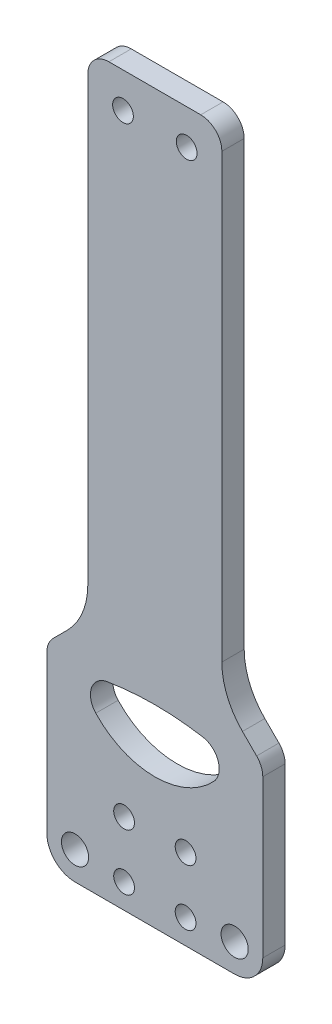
SolidWorks part; units mm, degrees
ref_plane "Front" through (0, 0, 0) normal (0, 0, 1) x (1, 0, 0)
ref_plane "Top" through (0, 0, 0) normal (0, 1, 0) x (1, 0, 0)
ref_plane "Right" through (0, 0, 0) normal (1, 0, 0) x (0, 0, -1)
sketch "Sketch1" plane through (0, 0, 0) normal (0, 0, 1) x (1, 0, 0)
  circle B0 centre (0, 0) radius 41 construction
  circle B1 centre (0, 0) radius 1.5875
  circle B2 centre (0, 0) radius 43.815
  circle B3 centre (0, 0) radius 10
  circle B4 centre (-19.1, -33.0822) radius 2.8
  circle B5 centre (-33.0822, -19.1) radius 1.5875
  circle B6 centre (0, -38.2) radius 1.5875
  circle B7 centre (-38.2, 0) radius 2.8
  circle B8 centre (-33.0822, 19.1) radius 1.5875
  circle B9 centre (-19.1, 33.0822) radius 2.8
  circle B10 centre (0, 38.2) radius 1.5875
  circle B11 centre (19.1, 33.0822) radius 2.8
  circle B12 centre (33.0822, 19.1) radius 1.5875
  circle B13 centre (38.2, 0) radius 2.8
  circle B14 centre (0, -38.2) radius 2.8
  circle B15 centre (33.0822, -19.1) radius 2.8
  circle B16 centre (19.1, -33.0822) radius 1.5875
  circle B17 centre (6.35, 37.6685) radius 1.5875
  circle B18 centre (-6.35, 37.6685) radius 1.5875
  line B19 (0, 0) -> (0, 41) construction
  circle B20 centre (6.35, 37.6685) radius 2.8 construction
  line B21 (0.8133, 36.6558) -> (-4.9156, 40.0732) construction
  circle B22 centre (0, 35.2924) radius 1.5875 construction
  circle B23 centre (0, 35.2924) radius 3.175 construction
  line B24 (0, -38.2) -> (0, 0) construction
  circle B25 centre (-19.1, -33.0822) radius 1.5875
  circle B26 centre (19.1, -33.0822) radius 2.8
  circle B27 centre (33.0822, -19.1) radius 1.5875
  circle B28 centre (38.2, 0) radius 1.5875
  circle B29 centre (33.0822, 19.1) radius 2.8
  circle B30 centre (19.1, 33.0822) radius 1.5875
  circle B31 centre (0, 38.2) radius 2.8
  circle B32 centre (-19.1, 33.0822) radius 1.5875
  circle B33 centre (-33.0822, 19.1) radius 2.8
  circle B34 centre (-38.2, 0) radius 1.5875
  circle B35 centre (-33.0822, -19.1) radius 2.8
  arc B36 (6.8154, 40.4296) -> (-6.8154, 40.4296) centre (0, 0) cw
  arc B37 (-6.8154, 40.4296) -> (-4.9156, 40.0732) centre (-6.35, 37.6685) cw
  circle B38 centre (-6.35, 37.6685) radius 2.8 construction
  arc B39 (-3.7276, 36.6872) -> (-4.9156, 40.0732) centre (-6.35, 37.6685) ccw
  line B40 (3.9049, 39.0328) -> (1.3863, 34.5189) construction
  line B41 (4.3688, 17) -> (4.3688, 25) construction
  circle B42 centre (4.3688, 25) radius 1.9304
  circle B43 centre (4.3688, 17) radius 1.9304
  circle B44 centre (-4.3688, 17) radius 1.9304
  circle B45 centre (-4.3688, 25) radius 1.9304
  line B46 (0, 48.315) -> (0, 135.945) construction
  line B47 (6.35, 48.315) -> (3.175, 48.315)
  line B48 (3.175, 135.945) -> (6.35, 135.945)
  line B49 (3.175, 135.945) -> (3.175, 133.13)
  line B50 (3.175, 48.315) -> (3.175, 51.13)
  line B51 (1.5875, 51.13) -> (3.175, 51.13)
  line B52 (0, 51.13) -> (1.5875, 51.13)
  line B53 (1.5875, 133.13) -> (3.175, 133.13)
  line B54 (0, 133.13) -> (1.5875, 133.13)
  line B55 (-6.35, 135.945) -> (-6.35, 48.315)
  line B56 (6.35, 135.945) -> (6.35, 48.315)
  line B57 (-3.175, 133.13) -> (0, 133.13)
  line B58 (-3.175, 135.945) -> (-6.35, 135.945)
  line B59 (-3.175, 135.945) -> (-3.175, 133.13)
  line B60 (6.35, 109.13) -> (-6.35, 109.13) construction
  line B61 (6.35, 106.8526) -> (-6.35, 106.8526) construction
  line B62 (0, 92.13) -> (6.35, 92.13) construction
  line B63 (0, 43.815) -> (0, 48.315) construction
  line B64 (-3.175, 51.13) -> (0, 51.13)
  line B65 (-3.175, 48.315) -> (-3.175, 51.13)
  line B66 (-6.35, 48.315) -> (-3.175, 48.315)
  line B67 (6.35, 102.13) -> (9.525, 102.13)
  line B68 (9.525, 82.13) -> (6.35, 82.13)
  line B69 (-9.525, 102.13) -> (-9.525, 82.13)
  line B70 (-9.525, 82.13) -> (-6.35, 82.13)
  line B71 (9.525, 82.13) -> (9.525, 102.13)
  line B72 (-6.35, 102.13) -> (-9.525, 102.13)
  line B73 (0, 25) -> (4.3688, 25) construction
  line B74 (0, 21.5) -> (0, 28.5) construction
  line B75 (0, 21.5) -> (9.525, 21.5) construction
  line B76 (0, 28.5) -> (9.525, 28.5) construction
  line B77 (9.525, 21.5) -> (9.525, 28.5) construction
  line B78 (9.525, 102.13) -> (11.9062, 102.13)
  line B79 (9.525, 102.13) -> (9.525, 13.5)
  line B80 (9.525, 13.5) -> (11.9063, 13.5)
  line B81 (0, 17) -> (4.3688, 17) construction
  line B82 (0, 13.5) -> (0, 20.5) construction
  line B83 (0, 20.5) -> (9.525, 20.5) construction
  line B84 (0, 13.5) -> (9.525, 13.5) construction
  line B85 (11.9062, 102.13) -> (11.9063, 13.5)
  line B86 (9.525, 13.5) -> (9.525, 20.5) construction
  circle B87 centre (0, 35.2924) radius 1.9304
  line B88 (-3.1521, 32.8624) -> (3.1521, 32.8624) construction
  arc B89 (-3.1521, 32.8624) -> (3.1521, 32.8624) centre (0, 35.2924) cw construction
  line B90 (-2.0435, 32.8624) -> (-3.1521, 32.8624)
  line B91 (2.0435, 32.8624) -> (3.1521, 32.8624)
  arc B92 (-3.7276, 36.6872) -> (-3.1521, 32.8624) centre (0, 35.2924) ccw
  arc B93 (6.8154, 40.4296) -> (4.9156, 40.0732) centre (6.35, 37.6685) ccw
  arc B94 (3.7276, 36.6872) -> (3.1521, 32.8624) centre (0, 35.2924) cw
  arc B95 (3.7276, 36.6872) -> (4.9156, 40.0732) centre (6.35, 37.6685) cw
  arc B96 (-2.0435, 32.8624) -> (2.0435, 32.8624) centre (0, 35.2924) ccw
sketch_block_instance "pulley_block-1"
sketch_block "Block1" parameters "D1"=82, "D2"=3.175, "D3"=87.63, "D4"=20, "D5"=3.175, "D7"=5.6, "D8"=4.9527, "D9"=5.2969, "D6"=3.175, "D10"=4.0029, "D11"=7.0541, "D12"=2, "D14"=5.7141, "D15"=5.3, "D18"=5.3, "D13"=5.3, "D19"=1.5252, "D27"=7.9375, "D16"=4.4488, "D17"=9.7371, "D20"=7, "D21"=10, "D22"=28.5815, "D23"=5.75, "D24"=12.7, "D25"=6.35, "D26"=6.35
sketch "Sketch2" plane through (0, 0, 0) normal (0, 0, 1) x (1, 0, 0)
  line L5 (-4.525, 116.8589) -> (-4.525, 111.8589) construction
  line L6 (-4.525, 111.8589) -> (-9.525, 111.8589) construction
  line L7 (0, 48.315) -> (0, 135.945) construction
  line L8 (0, 43.815) -> (0, 135.945) construction
  line L9 (-15.3431, 13.5) -> (15.3431, 13.5)
  line L11 (15.3431, 13.5) -> (15.3431, 41.0407)
  line L13 (9.525, 102.13) -> (9.525, 13.5) construction
  line L14 (9.525, 46.8589) -> (9.525, 116.8589)
  line L15 (9.525, 116.8589) -> (-9.525, 116.8589)
  line L16 (-9.525, 46.8589) -> (-9.525, 116.8589)
  line L22 (15.3431, 41.0407) -> (9.525, 46.8589)
  line L27 (-15.3431, 41.0407) -> (-9.525, 46.8589)
  line L28 (-15.3431, 13.5) -> (-15.3431, 41.0407)
  circle A0 centre (4.3688, 17) radius 1.4732
  circle A1 centre (4.3688, 25) radius 1.4732
  circle A2 centre (-4.3688, 25) radius 1.4732
  circle A3 centre (-4.3688, 17) radius 1.4732
  arc A4 (8.3927, 35.7535) -> (6.8154, 40.4296) centre (6.35, 37.6685) ccw
  arc A5 (-8.3927, 35.7535) -> (-6.8154, 40.4296) centre (-6.35, 37.6685) cw
  circle A6 centre (-4.525, 111.8589) radius 1.4732
  circle A7 centre (4.525, 111.8589) radius 1.4732
  circle A9 centre (0, 0) radius 13.5 construction
  arc A10 (8.3927, 35.7535) -> (-8.3927, 35.7535) centre (0, 43.6214) cw
  circle A11 centre (6.35, 37.6685) radius 2.8 construction
  circle A12 centre (-6.35, 37.6685) radius 2.8 construction
  arc A13 (-6.8154, 40.4296) -> (6.8154, 40.4296) centre (0, 0) cw
  arc A14 (-2.0435, 32.8624) -> (2.0435, 32.8624) centre (0, 35.2924) ccw construction
  circle A17 centre (0, 0) radius 43.815 construction
  circle A18 centre (-11.3431, 17.5) radius 1.9304
  circle A19 centre (11.3431, 17.5) radius 1.9304
  circle A21 centre (-11.3431, 17.5) radius 4 construction
  dimension "D1" = 2.9464
  dimension "D6" = 17.5
  dimension "D7" = 11.3431
  dimension "D8" = 27
  dimension "D9" = 3.8608
  dimension "D5" = 8
  dimension "D2" = 135
  dimension "D3" = 5
  dimension "D4" = 70
extrude "Boss-Extrude1" add sketch "Sketch2" along normal blind 3.175
fillet "Fillet1" radius 3 4 edges at (-9.525, 116.8589, 1.5875) (9.525, 116.8589, 1.5875) (-15.3431, 41.0407, 1.5875) (15.3431, 41.0407, 1.5875)
fillet "Fillet2" radius 10 2 edges at (-9.525, 46.8589, 1.5875) (9.525, 46.8589, 1.5875)
fillet "Fillet3" radius 4 2 edges at (-15.3431, 13.5, 1.5875) (15.3431, 13.5, 1.5875)
other "Move Face1" [suppressed] parameters "D1"=0.0762
